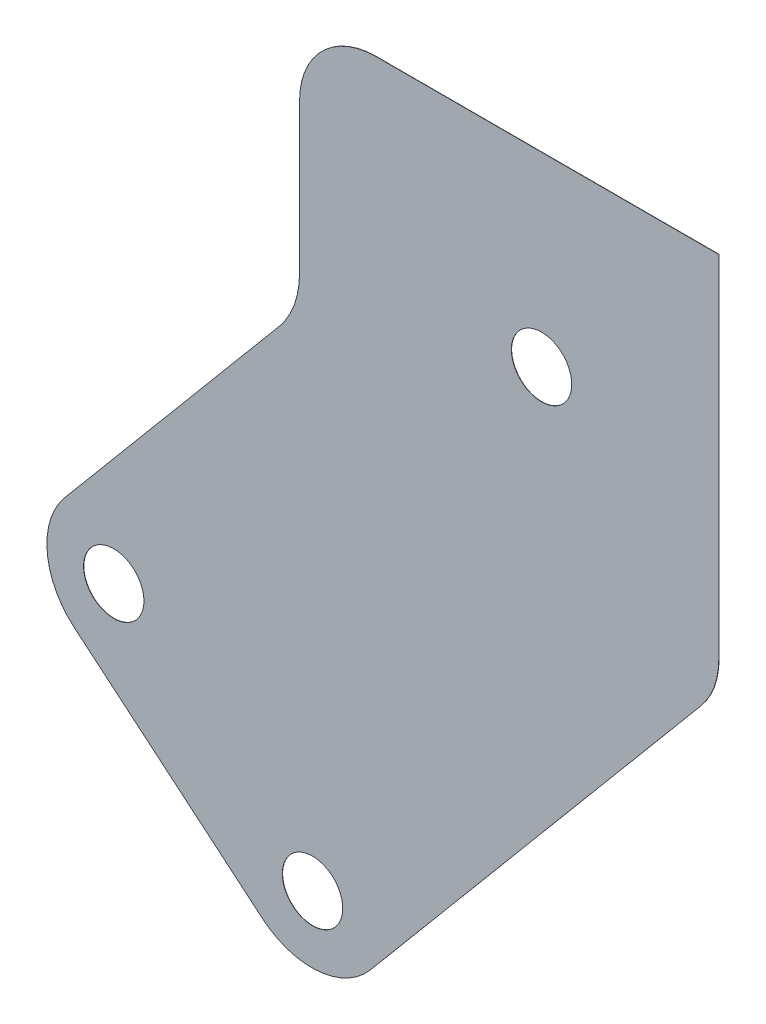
SolidWorks part; units mm, degrees
ref_plane "Front" through (0, 0, 0) normal (0, 0, 1) x (1, 0, 0)
ref_plane "Top" through (0, 0, 0) normal (0, 1, 0) x (1, 0, 0)
ref_plane "Right" through (0, 0, 0) normal (1, 0, 0) x (0, 0, -1)
sketch "Sketch1" plane through (0, 0, 0) normal (0, 0, 1) x (1, 0, 0)
  line L12 (-545.8392, -13.7079) -> (-577.7162, -13.7079)
  line L13 (-545.8392, -46.3196) -> (-545.8392, -13.7079)
  line L14 (-578.2513, -87.5355) -> (-547.503, -50.8911)
  line L15 (-605.7827, -73.7179) -> (-588.2709, -88.4121)
  line L16 (-586.7297, -39.9472) -> (-606.6593, -63.6983)
  line L17 (-584.8282, -20.8199) -> (-584.8282, -34.7227)
  line L18 (-545.8392, -13.7079) -> (-577.7162, -13.7079)
  line L19 (-545.8392, -46.3196) -> (-545.8392, -13.7079)
  line L20 (-578.2513, -87.5355) -> (-547.503, -50.8911)
  line L21 (-605.7827, -73.7179) -> (-588.2709, -88.4121)
  line L22 (-586.7297, -39.9472) -> (-606.6593, -63.6983)
  line L23 (-584.8282, -20.8199) -> (-584.8282, -34.7227)
  arc A8 (-547.503, -50.8911) -> (-545.8392, -46.3196) centre (-552.9512, -46.3196) ccw
  arc A9 (-588.2709, -88.4121) -> (-578.2513, -87.5355) centre (-583.6994, -82.9639) ccw
  arc A10 (-606.6593, -63.6983) -> (-605.7827, -73.7179) centre (-601.2112, -68.2698) ccw
  arc A11 (-586.7297, -39.9472) -> (-584.8282, -34.7227) centre (-592.9562, -34.7227) ccw
  arc A12 (-547.503, -50.8911) -> (-545.8392, -46.3196) centre (-552.9512, -46.3196) ccw
  arc A13 (-588.2709, -88.4121) -> (-578.2513, -87.5355) centre (-583.6994, -82.9639) ccw
  arc A14 (-606.6593, -63.6983) -> (-605.7827, -73.7179) centre (-601.2112, -68.2698) ccw
  arc A15 (-586.7297, -39.9472) -> (-584.8282, -34.7227) centre (-592.9562, -34.7227) ccw
  arc A18 (-577.7162, -13.7079) -> (-584.8282, -20.8199) centre (-577.7162, -20.8199) ccw
  arc A19 (-577.7162, -13.7079) -> (-584.8282, -20.8199) centre (-577.7162, -20.8199) ccw
  dimension "D1" = 0.508
extrude "Boss-Extrude1" add sketch "Sketch1" along normal blind 0.0254 separate body
hole_wizard "Hole1" positions "Point_Sketch" profile "Profil_Sketch" hole size "Ø0.15" standard "ISO"
sketch "Point_Sketch" plane through (-605.7682, -57.7567, 0.0254) normal (0, 0, -1) x (1, 0, 0)
  point P0 (3.6624, 10.5914)
  point P2 (22.1471, 26.1019)
  point P4 (43.4444, -26.7481)
sketch "Profil_Sketch" plane through (-602.1058, -68.3481, 0.0254) normal (1, 0, 0) x (0, -1, 0)
  line L0 (0, 0) -> (0, 0.0254)
  line L1 (0, 0.0254) -> (2.8067, 0.0254)
  line L2 (2.8067, 0.0254) -> (2.8067, 0)
  line L5 (2.8067, 0) -> (0, 0)
  line L11 (0, -6.35) -> (0, 107.95) construction
  dimension "Diameter" = 5.6134
  dimension "Thru Hole Depth" = 0.0254
other "usin_DL090_10-24x1.75-SHCS<1>"
